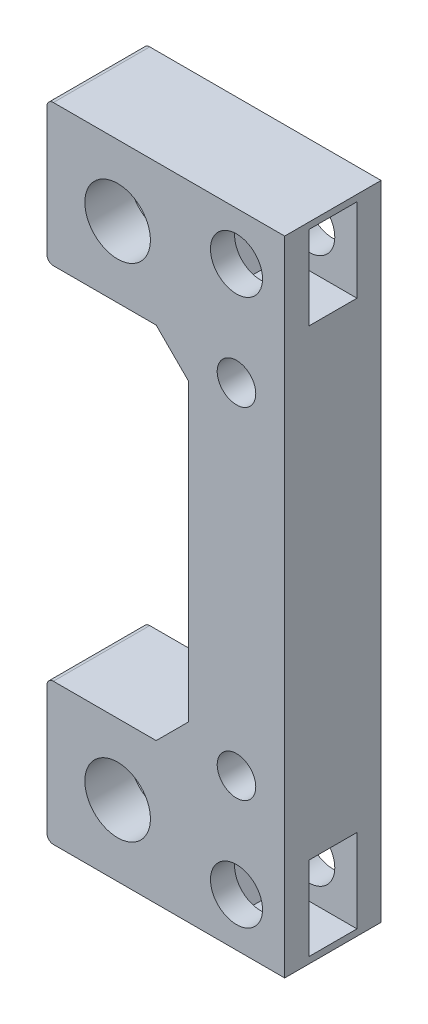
SolidWorks part; units mm, degrees
ref_plane "Plan de face" through (0, 0, 0) normal (0, 0, 1) x (1, 0, 0)
ref_plane "Plan de dessus" through (0, 0, 0) normal (0, 1, 0) x (1, 0, 0)
ref_plane "Plan de droite" through (0, 0, 0) normal (1, 0, 0) x (0, 0, -1)
sketch "Esquisse1" plane through (0, 0, 0) normal (0, 0, 1) x (1, 0, 0)
  line L1 (0, 0) -> (15, 0)
  line L2 (0, 0) -> (0, -100)
  line L3 (0, -100) -> (15, -100)
  line L10 (15, 0) -> (15, -100)
  dimension "D1" = 15
  dimension "D5" = 100
extrude "Boss.-Extru.1" add sketch "Esquisse1" along normal blind 15
sketch "Esquisse2" plane through (0, 0, 15) normal (0, 0, 1) x (1, 0, 0)
  line L0 (7.5, -23.5) -> (7.5, -76.5) construction
  line L1 (0, 0) -> (0, -100) construction
  circle A0 centre (7.5, -23.5) radius 3
  circle A1 centre (7.5, -76.5) radius 3
  point P6 (0, -50)
  point P7 (7.5, -50)
  dimension "D1" = 6
  dimension "D3" = 7.5
  dimension "D2" = 53
extrude "Enlèv. mat.-Extru.2" cut sketch "Esquisse2" against normal blind 37
sketch "Esquisse8" plane through (0, 0, 0) normal (0, 0, -1) x (-1, 0, 0)
  line L1 (-7.5, -70.7265) -> (-12.5, -73.6132)
  line L2 (-12.5, -73.6132) -> (-12.5, -79.3868)
  line L3 (-12.5, -79.3868) -> (-7.5, -82.2735)
  line L4 (-7.5, -82.2735) -> (-2.5, -79.3868)
  line L5 (-2.5, -79.3868) -> (-2.5, -73.6132)
  line L6 (-2.5, -73.6132) -> (-7.5, -70.7265)
  line L7 (-7.5, -17.7265) -> (-12.5, -20.6132)
  line L8 (-12.5, -20.6132) -> (-12.5, -26.3868)
  line L9 (-12.5, -26.3868) -> (-7.5, -29.2735)
  line L10 (-7.5, -29.2735) -> (-2.5, -26.3868)
  line L11 (-2.5, -26.3868) -> (-2.5, -20.6132)
  line L12 (-2.5, -20.6132) -> (-7.5, -17.7265)
  line L13 (-15, -100) -> (-15, 0) construction
  circle A0 centre (-7.5, -76.5) radius 5 construction
  circle A1 centre (-7.5, -23.5) radius 5 construction
  dimension "D1" = 10
  dimension "D2" = 10
extrude "Enlèv. mat.-Extru.6" cut sketch "Esquisse8" against normal blind 10
sketch "Esquisse10" plane through (0, 0, 15) normal (0, 0, 1) x (1, 0, 0)
  line L0 (15, -100) -> (15, 0) construction
  line L1 (15, 0) -> (0, 0) construction
  line L2 (0, -100) -> (15, -100) construction
  circle A0 centre (7.5, -7.5) radius 4.05
  circle A1 centre (7.5, -92.5) radius 4.05
  dimension "D1" = 8.1
  dimension "D2" = 7.5
  dimension "D3" = 7.5
  dimension "D4" = 7.5
extrude "Enlèv. mat.-Extru.7" cut sketch "Esquisse10" against normal through all
sketch "Esquisse11" plane through (0, 0, 15) normal (0, 0, 1) x (1, 0, 0)
  line L1 (3.7472, -14) -> (15, -14)
  line L4 (15, -1) -> (3.7472, -1)
  line L5 (3.7472, -1) -> (-0.0056, -7.5)
  line L6 (-0.0056, -7.5) -> (3.7472, -14)
  line L7 (3.7472, -86) -> (-0.0056, -92.5)
  line L8 (-0.0056, -92.5) -> (3.7472, -99)
  line L9 (3.7472, -99) -> (15, -99)
  line L12 (15, -86) -> (3.7472, -86)
  line L13 (15, 0) -> (0, 0) construction
  line L15 (15, -100) -> (15, 0) construction
  line L16 (15, -1) -> (15, -14)
  line L19 (11.2528, -14) -> (13.1292, -10.75)
  line L21 (15, -86) -> (15, -99)
  line L24 (11.2528, -99) -> (13.1292, -95.75)
  line L25 (16.8212, -95.6449) -> (15, -92.4904)
  line L26 (17.7025, -12.1712) -> (15, -7.4904)
  circle A0 centre (7.5, -7.5) radius 6.5 construction
  circle A1 centre (7.5, -92.5) radius 6.5 construction
  dimension "D1" = 13
  dimension "D2" = 13
extrude "Enlèv. mat.-Extru.8" cut sketch "Esquisse11" against normal blind 7.5 from offset 3.75
sketch "Esquisse12" plane through (0, 0, 0) normal (0, 0, -1) x (-1, 0, 0)
  line L1 (0, -100) -> (22, -100)
  line L2 (0, -100) -> (0, -78)
  line L3 (0, -78) -> (22, -78)
  line L4 (22, -100) -> (22, -78)
  line L5 (0, 0) -> (22, 0)
  line L6 (0, 0) -> (0, -22)
  line L7 (0, -22) -> (22, -22)
  line L8 (22, 0) -> (22, -22)
  dimension "D1" = 22
  dimension "D2" = 22
  dimension "D3" = 22
  dimension "D4" = 22
extrude "Boss.-Extru.2" add sketch "Esquisse12" against normal blind 15
sketch "Esquisse13" plane through (0, 0, 0) normal (0, 0, -1) x (-1, 0, 0)
  line L0 (22, -100) -> (22, -78) construction
  line L1 (22, -100) -> (-15, -100) construction
  line L2 (0, -22) -> (22, -22) construction
  line L4 (22, -22) -> (22, 0) construction
  circle A0 centre (11, -89) radius 5.1
  circle A1 centre (11, -11) radius 5.1
  dimension "D1" = 10.2
  dimension "D3" = 11
  dimension "D4" = 11
  dimension "D2" = 11
  dimension "D5" = 11
extrude "Enlèv. mat.-Extru.9" cut sketch "Esquisse13" against normal blind 15
sketch "Esquisse14" plane through (0, 0, 0) normal (0, 0, -1) x (-1, 0, 0)
  line L1 (11, -79.7624) -> (3, -84.3812)
  line L2 (3, -84.3812) -> (3, -93.6188)
  line L3 (3, -93.6188) -> (11, -98.2376)
  line L4 (11, -98.2376) -> (19, -93.6188)
  line L5 (19, -93.6188) -> (19, -84.3812)
  line L6 (19, -84.3812) -> (11, -79.7624)
  line L8 (22, -100) -> (22, -78) construction
  line L9 (22, -22) -> (22, 0) construction
  line L10 (19, -6.3812) -> (11, -1.7624)
  line L11 (11, -1.7624) -> (3, -6.3812)
  line L12 (3, -6.3812) -> (3, -15.6188)
  line L13 (3, -15.6188) -> (11, -20.2376)
  line L14 (11, -20.2376) -> (19, -15.6188)
  line L15 (19, -15.6188) -> (19, -6.3812)
  circle A0 centre (11, -89) radius 8 construction
  circle A1 centre (11, -11) radius 8 construction
  dimension "D1" = 16
  dimension "D2" = 16
extrude "Enlèv. mat.-Extru.10" cut sketch "Esquisse14" against normal blind 8
fillet "Congé1" radius 1 4 edges at (-22, 0, 7.5) (-22, -22, 7.5) (-22, -78, 7.5) (-22, -100, 7.5)
chamfer "Chanfrein1" distance 5 angle 45 2 edges at (0, -22, 7.5) (0, -78, 7.5)
